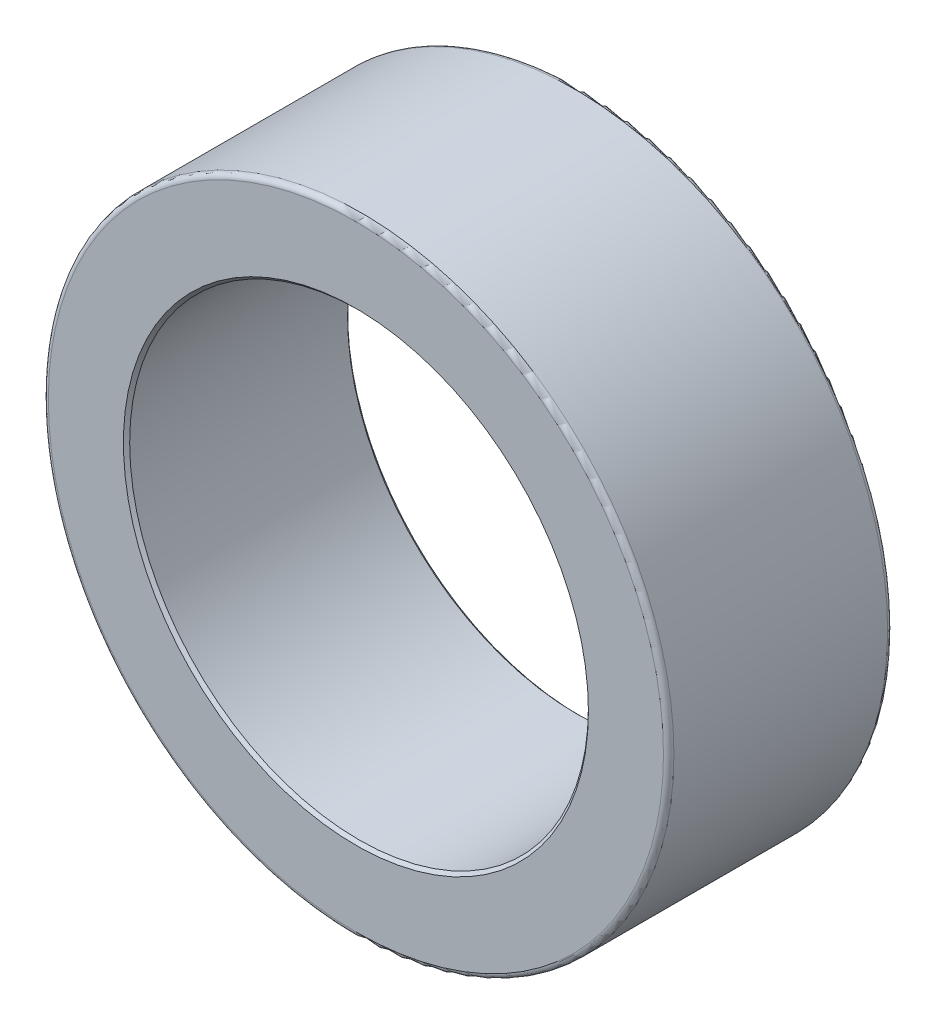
SolidWorks part; units mm, degrees
ref_plane "Face" through (0, 0, 0) normal (0, 0, 1) x (1, 0, 0)
ref_plane "Dessus" through (0, 0, 0) normal (0, 1, 0) x (1, 0, 0)
ref_plane "Droite" through (0, 0, 0) normal (1, 0, 0) x (0, 0, -1)
sketch "Esquisse1" plane through (0, 0, 0) normal (0, 0, 1) x (1, 0, 0)
  circle A0 centre (0, 0) radius 22
  circle A1 centre (0, 0) radius 30
  dimension "D1" = 44
  dimension "D2" = 60
extrude "Base-Extrusion" add sketch "Esquisse1" against normal blind 21.5
fillet "Congé2" radius 0.5
chamfer "Chanfrein1" distance 0.3 angle 45
